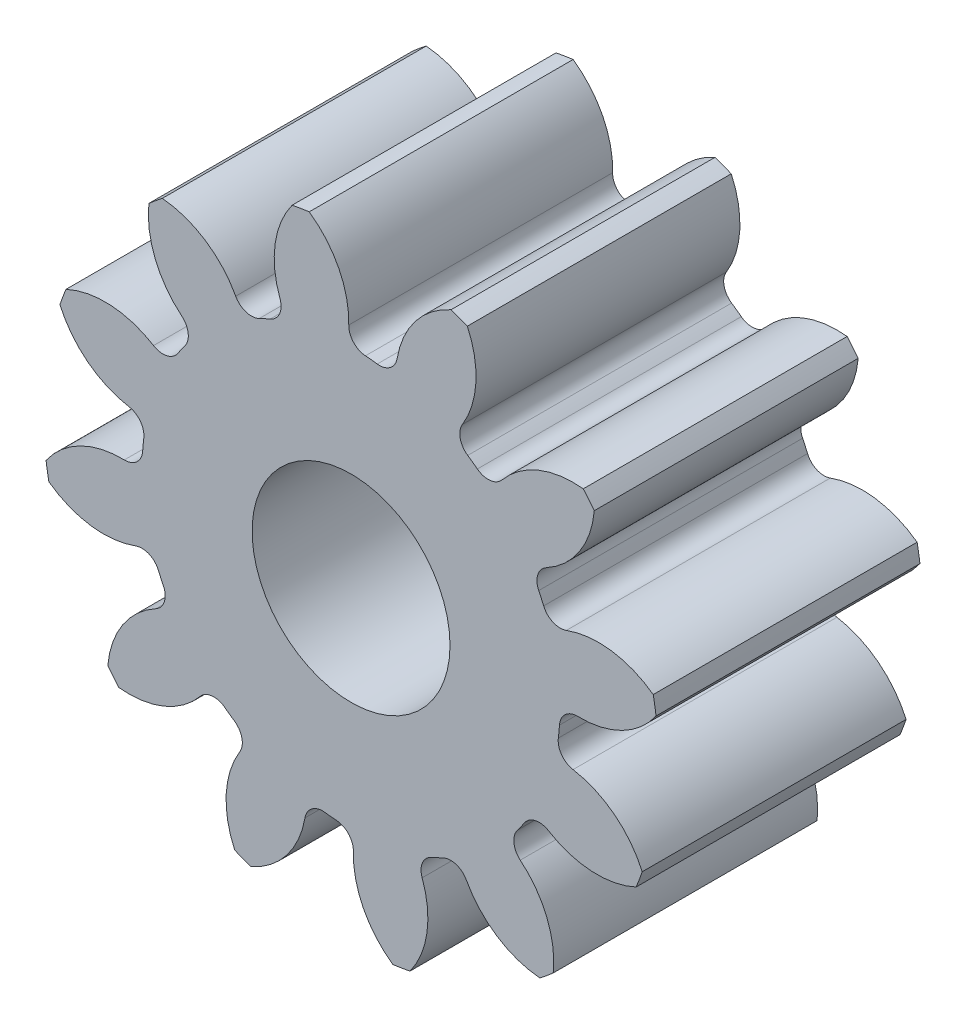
SolidWorks part; units mm, degrees
ref_plane "Front" through (0, 0, 0) normal (0, 0, 1) x (1, 0, 0)
ref_plane "Top" through (0, 0, 0) normal (0, 1, 0) x (1, 0, 0)
ref_plane "Right" through (0, 0, 0) normal (1, 0, 0) x (0, 0, -1)
sketch "Sketch3" plane through (0, 0, 0) normal (0, 0, 1) x (1, 0, 0)
  circle A0 centre (0, 0) radius 118.5333
  dimension "od" = 237.0667
extrude "gearBody" add sketch "Sketch3" along normal blind 101.6
sketch "Sketch2" plane through (0, 0, 0) normal (0, 0, 1) x (1, 0, 0)
  line L0 (0, 0) -> (88.2053, 36.5358) construction
  line L1 (112.8595, -40.3576) -> (0, 0) construction
  line L2 (0, 0) -> (36.3143, 0) construction
  line L3 (101.5411, 3.46) -> (98.9555, -23.0296) construction
  line L5 (100.2483, -9.7848) -> (0, 0) construction
  line L7 (0, 0) -> (95.4728, 0) construction
  arc A0 (95.4591, 1.6182) -> (93.3444, -20.0466) centre (0, 0) ccw construction
  arc A1 (117.4345, 16.1027) -> (112.1042, -38.507) centre (0, 0) ccw construction
  arc A2 (101.5411, 3.46) -> (98.9555, -23.0296) centre (0, 0) ccw construction
  arc A3 (79.798, -10.0896) -> (80.2429, -5.5313) centre (0, 0) ccw
  arc A4 (112.8595, -40.3576) -> (85.4759, -17.7478) centre (79.4756, -52.9025) ccw
  arc A5 (112.8595, -40.3576) -> (118.5333, 17.7724) centre (0, 0) ccw
  arc A6 (118.5333, 17.7724) -> (87.2945, 0.8844) centre (88.2053, 36.5358) cw
  arc A7 (80.2429, -5.5313) -> (87.2945, 0.8844) centre (87.1185, -6.0052) cw
  arc A8 (85.4759, -17.7478) -> (79.798, -10.0896) centre (86.6354, -10.9542) cw
  point P6 (118.5333, 17.7724)
  point P22 (112.8595, -40.3576)
  dimension "baseDia" = 190.9455
  dimension "od" = 237.0667
  dimension "pd" = 203.2
  dimension "rd" = 160.8667
  dimension "rFillet" = 6.8919
  dimension "pointX" = 118.5333
  dimension "pointY" = 17.7724
  dimension "CTT" = 26.4896
  dimension "flankCenterAngle" = 22.5
extrude "toothCut" cut sketch "Sketch2" along normal through all
pattern_circular "CirPattern1" count 12 over 360 about axis through (0, 0, 0) along (0, 0, 1) of "toothCut"
sketch "hub1Dia" plane through (0, 0, 0) normal (0, 0, -1) x (-1, 0, 0)
  circle A0 centre (0, 0) radius 12.7
  dimension "hub1Dia" = 25.4
sketch "hub2Dia" plane through (0, 0, 101.6) normal (0, 0, 1) x (1, 0, 0)
  circle A0 centre (0, 0) radius 12.7
  dimension "hub2dia" = 25.4
sketch "boreDia" plane through (0, 0, 0) normal (0, 0, 1) x (1, 0, 0)
  circle A0 centre (0, 0) radius 38.1
  dimension "boreDia" = 76.2
extrude "bore" cut sketch "boreDia" against normal mid plane 25400
